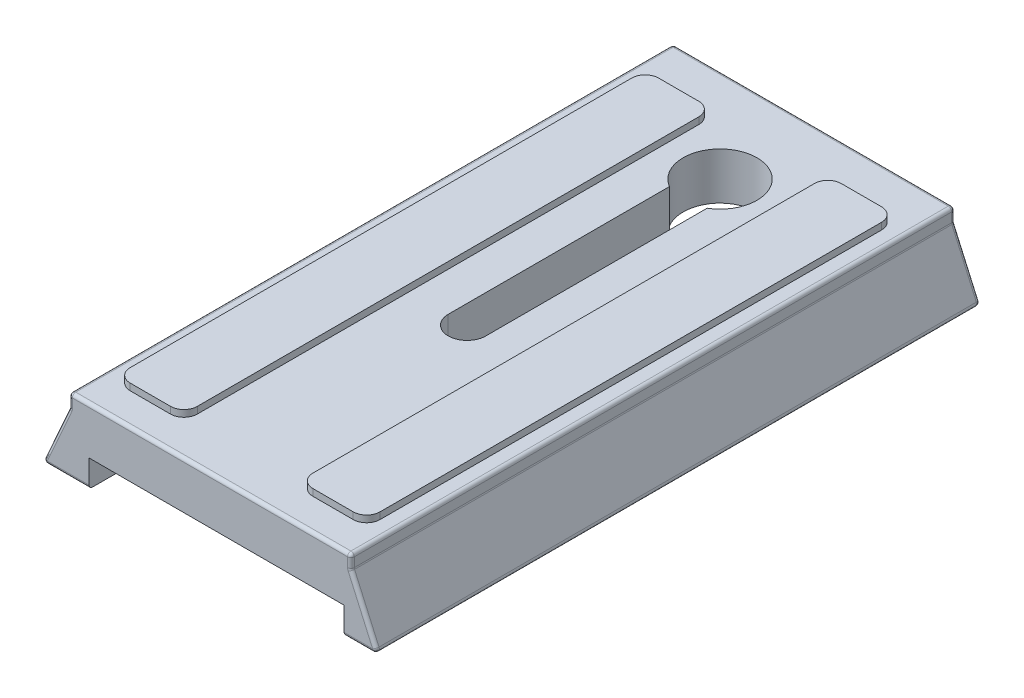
SolidWorks part; units mm, degrees
ref_plane "Front Plane" through (0, 0, 0) normal (0, 0, 1) x (1, 0, 0)
ref_plane "Top Plane" through (0, 0, 0) normal (0, 1, 0) x (1, 0, 0)
ref_plane "Right Plane" through (0, 0, 0) normal (1, 0, 0) x (0, 0, -1)
sketch "Sketch2" plane through (0, 0, 0) normal (0, 0, 1) x (1, 0, 0)
  line L0 (0, 0) -> (50, 0)
  line L1 (4, 11) -> (46, 11)
  line L2 (46, 11) -> (46, 9)
  line L3 (46, 9) -> (50, 0)
  line L4 (4, 9) -> (0, 0)
  line L5 (4, 11) -> (4, 9)
extrude "Boss-Extrude1" add sketch "Sketch2" against normal blind 90
sketch "Sketch3" plane through (0, 0, 0) normal (0, -1, 0) x (1, 0, 0)
  line L0 (9.5, -41) -> (14.4, -41)
  line L2 (7, -38.5) -> (7, 0)
  line L3 (0, 0) -> (50, 0) construction
  line L4 (40, -90) -> (46, -90)
  line L6 (15, -41.6) -> (15, -45.4)
  line L7 (7, 0) -> (45, 0)
  line L8 (4, -48.5) -> (4, -87.4)
  line L10 (14.4, -46) -> (6.5, -46)
  line L11 (40, -90) -> (40, -87.4)
  line L12 (40, -87.4) -> (4, -87.4)
  line L13 (46, -43) -> (40.2, -43)
  line L14 (46, -90) -> (46, -43)
  line L18 (45, 0) -> (40.2, -43)
  arc A0 (6.5, -46) -> (4, -48.5) centre (6.5, -48.5) ccw
  arc A1 (9.5, -41) -> (7, -38.5) centre (9.5, -38.5) cw
  arc A2 (15, -45.4) -> (14.4, -46) centre (14.4, -45.4) cw
  arc A3 (14.4, -41) -> (15, -41.6) centre (14.4, -41.6) cw
  dimension "D1" = 2.5
  dimension "D2" = 0.6
extrude "Cut-Extrude1" cut sketch "Sketch3" against normal blind 4
sketch "Sketch4" plane through (0, 4, 0) normal (0, -1, 0) x (1, 0, 0)
  line L2 (22.2, -38.3) -> (22.2, -71.2661)
  line L4 (27.8, -38.3) -> (27.8, -71.2661)
  arc A0 (27.8, -38.3) -> (22.2, -38.3) centre (25, -38.3) ccw
  arc A1 (22.2, -71.2661) -> (27.8, -71.2661) centre (25, -76) ccw
  dimension "D1" = 5.6
  dimension "D2" = 11
extrude "Cut-Extrude2" cut sketch "Sketch4" against normal blind 26
fillet "Fillet2" radius 2 1 edges at (46, 2, -43)
sketch "Sketch5" plane through (0, 4, 0) normal (0, -1, 0) x (1, 0, 0)
  line L0 (25, -38.3) -> (25, -71.2661) construction
  line L1 (17.35, -38.3) -> (17.35, -69.2661)
  line L2 (32.65, -38.3) -> (32.65, -69.2661)
  line L3 (19.35, -71.2661) -> (30.65, -71.2661)
  line L4 (32.65, -38.3) -> (32.65, -71.2661) construction
  line L5 (17.35, -38.3) -> (17.35, -71.2661) construction
  arc A0 (17.35, -38.3) -> (32.65, -38.3) centre (25, -38.3) cw
  arc A1 (32.65, -69.2661) -> (30.65, -71.2661) centre (30.65, -69.2661) cw
  arc A2 (17.35, -69.2661) -> (19.35, -71.2661) centre (19.35, -69.2661) ccw
  dimension "D3" = 2
  dimension "D1" = 7.65
  dimension "D2" = 7.65
extrude "Cut-Extrude3" cut sketch "Sketch5" against normal blind 0.8
fillet "Fillet3" radius 0.5 1 edges at (40.2, 2, -43)
fillet "Fillet4" radius 0.5 2 edges at (50, 0, -45) (0, 0, -45)
sketch "Sketch6" plane through (0, 11, 0) normal (0, 1, 0) x (1, 0, 0)
  line L1 (33.6127, 81.4507) -> (33.6127, 6.7272)
  line L2 (43.6127, 81.4507) -> (43.6127, 6.7272)
  line L3 (35.6127, 83.4507) -> (41.6127, 83.4507)
  line L4 (35.6127, 4.7272) -> (41.6127, 4.7272)
  line L6 (14.3873, 4.7272) -> (8.3873, 4.7272)
  line L7 (14.3873, 83.4507) -> (8.3873, 83.4507)
  line L8 (6.3873, 81.4507) -> (6.3873, 6.7272)
  line L9 (16.3873, 81.4507) -> (16.3873, 6.7272)
  arc A0 (43.6127, 81.4507) -> (41.6127, 83.4507) centre (41.6127, 81.4507) ccw
  arc A1 (33.6127, 81.4507) -> (35.6127, 83.4507) centre (35.6127, 81.4507) cw
  arc A2 (33.6127, 6.7272) -> (35.6127, 4.7272) centre (35.6127, 6.7272) ccw
  arc A3 (43.6127, 6.7272) -> (41.6127, 4.7272) centre (41.6127, 6.7272) cw
  arc A4 (6.3873, 6.7272) -> (8.3873, 4.7272) centre (8.3873, 6.7272) ccw
  arc A5 (16.3873, 6.7272) -> (14.3873, 4.7272) centre (14.3873, 6.7272) cw
  arc A6 (16.3873, 81.4507) -> (14.3873, 83.4507) centre (14.3873, 81.4507) ccw
  arc A7 (6.3873, 81.4507) -> (8.3873, 83.4507) centre (8.3873, 81.4507) cw
  dimension "D3" = 2
extrude "Boss-Extrude2" add sketch "Sketch6" along normal blind 1
fillet "Fillet5" radius 0.5 22 edges at (0.3501, 0.2275, 0) (49.6499, 0.2275, 0) (0.3501, 0.2275, -90) (49.6499, 0.2275, -90) (2.1562, 4.8515, 0) (47.1153, 0, 0) (3.8847, 0, 0) (47.8438, 4.8515, 0) (46, 10, 0) (25, 11, 0) (4, 10, 0) (2.1562, 4.8515, -90) (47.6153, 0, -90) (20.3847, 0, -90) (47.8438, 4.8515, -90) (46, 10, -90) (4, 10, -90) (46, 9, -45) (46, 11, -45) (4, 11, -45) (4, 9, -45) (25, 11, -90)
